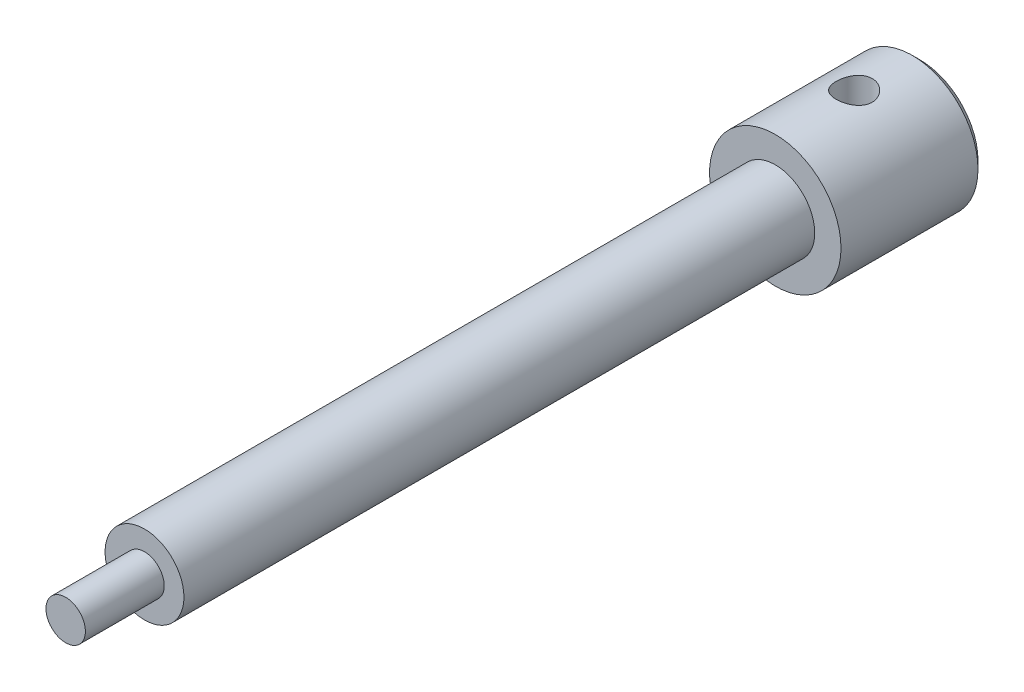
SolidWorks part; units mm, degrees
ref_plane "Front Plane" through (0, 0, 0) normal (0, 0, 1) x (1, 0, 0)
ref_plane "Top Plane" through (0, 0, 0) normal (0, 1, 0) x (1, 0, 0)
ref_plane "Right Plane" through (0, 0, 0) normal (1, 0, 0) x (0, 0, -1)
sketch "Sketch2" plane through (0, 0, 0) normal (0, 0, 1) x (1, 0, 0)
  circle A0 centre (0, 0) radius 10
  dimension "D1" = 20
extrude "Boss-Extrude1" add sketch "Sketch2" against normal blind 22
sketch "Sketch3" plane through (0, 0, 0) normal (0, 0, 1) x (1, 0, 0)
  circle A0 centre (0, 0) radius 6
  dimension "D1" = 12
extrude "Boss-Extrude2" add sketch "Sketch3" along normal blind 96
sketch "Sketch4" plane through (0, 0, 96) normal (0, 0, 1) x (1, 0, 0)
  circle A0 centre (0, 0) radius 3
  dimension "D1" = 6
extrude "Boss-Extrude3" add sketch "Sketch4" along normal blind 12
sketch "Sketch5" plane through (0, 0, 0) normal (0, 1, 0) x (1, 0, 0)
  circle A0 centre (0, 12) radius 2.75
  point P2 (0, 0)
  dimension "D1" = 5.5
  dimension "D2" = 12
  dimension "D3" = 12
extrude "Cut-Extrude1" cut sketch "Sketch5" against normal through all and the other way through all contours A0
chamfer "Chamfer1" distance 1.15 angle 45 1 edges at (10, 0, -22)
